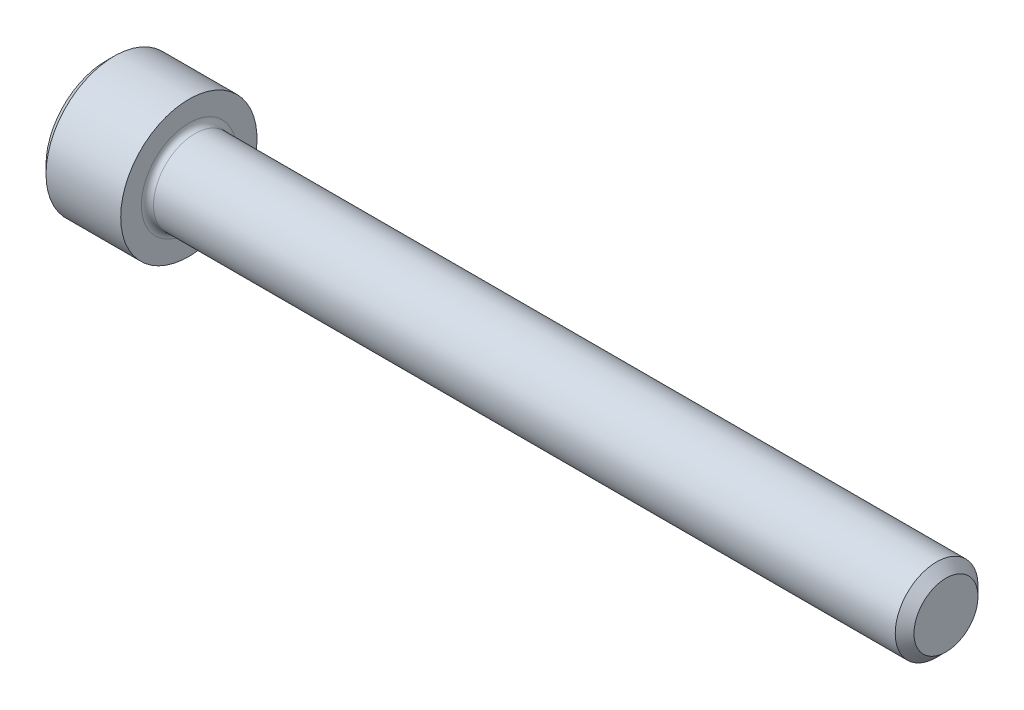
SolidWorks part; units mm, degrees
revolve "Base-Revolve" add sketch "BodySke"
sketch "BodySke" plane through (0, 0, 0) normal (0, 0, 1) x (1, 0, 0)
  line L0 (0, 0) -> (0, 3.0226)
  line L1 (0.4064, 3.429) -> (4.1656, 3.429)
  line L2 (4.1656, 3.429) -> (4.1656, 2.0828)
  line L3 (4.1656, 2.0828) -> (41.7932, 2.0828)
  line L4 (42.2656, 1.6104) -> (42.2656, 0)
  line L5 (42.2656, 0) -> (0, 0)
  line L6 (-31.75, 0) -> (127, 0) construction
  line L7 (0, 3.0226) -> (0.4064, 3.429)
  line L8 (42.2656, 1.6104) -> (41.7932, 2.0828)
  line L9 (0, -3.0226) -> (0.4064, -3.429) construction
  line L10 (42.2656, -1.6104) -> (41.7932, -2.0828) construction
  line L11 (4.9581, 9.525) -> (4.9581, 3.175) construction
  line L12 (13.6906, 9.525) -> (13.6906, 3.175) construction
  line L13 (4.1656, 9.525) -> (4.1656, 3.175) construction
  dimension "Diameter" = 4.1656
  dimension "Head_ht" = 4.1656
  dimension "Length" = 38.1
  dimension "Body_ch_ang" = 45
  dimension "Head_dia" = 6.858
  dimension "Head_ch_ang" = 45
  dimension "Head_side_ht" = 3.7592
  dimension "Minor_dia" = 3.2207
  dimension "Advance" = 0.7925
  dimension "Thread_nom" = 28.575
  dimension "Thread_length" = 38.1
fillet "Fillet1" radius 0.3048 1 edges at (4.1656, 0, 2.0828)
ref_plane "Plane1" through (0, 0, 0) normal (0, 0, 1) x (1, 0, 0)
ref_plane "Plane2" through (0, 0, 0) normal (0, 1, 0) x (1, 0, 0)
ref_plane "Plane3" through (0, 0, 0) normal (1, 0, 0) x (0, 0, -1)
sketch "Sketch2" plane through (0, 0, 0) normal (0, 0, 1) x (1, 0, 0)
  line L0 (0, 1.778) -> (1.9558, 1.778)
  line L1 (1.9558, 1.778) -> (2.9823, 0)
  line L2 (-31.75, 0) -> (127, 0) construction
  line L3 (2.9823, 0) -> (0, 0)
  line L4 (0, 0) -> (0, 1.778)
  line L5 (0, 3.0226) -> (0, -3.0226) construction
  line L6 (0, 0) -> (47.625, 0) construction
  line L7 (4.1656, -3.429) -> (4.1656, 3.429) construction
revolve "Hex-PreBroach" cut sketch "Sketch2" angle 360 about L6
sketch "Sketch3" plane through (0, 0, 0) normal (-1, 0, 0) x (0, 0.5, 0.866)
  line L0 (1.0265, 1.778) -> (-1.0265, 1.778)
  line L1 (-1.0265, 1.778) -> (-2.0531, 0)
  line L2 (1.0265, 1.778) -> (2.0531, 0)
  line L3 (1.0265, -1.778) -> (2.0531, 0)
  line L4 (1.0265, -1.778) -> (-1.0265, -1.778)
  line L5 (-1.0265, -1.778) -> (-2.0531, 0)
extrude "Hex" cut sketch "Sketch3" against normal blind 1.9558
sketch "Sketch4" plane through (0, 0, 0) normal (-1, 0, 0) x (0, 0, 1)
  line L0 (0, 0) -> (2.1971, 0)
  line L1 (0, 0) -> (6.1484, 3.5498) construction
  line L2 (0, 0) -> (1.0985, 1.9027)
  line L3 (1.8302, 0.5287) -> (2.0897, 0.6786)
  line L4 (1.373, 1.3206) -> (1.6325, 1.4704)
  arc A0 (1.8302, 0.5287) -> (1.373, 1.3206) centre (0, 0) ccw
  arc A1 (2.1971, 0) -> (2.0897, 0.6786) centre (0, 0) ccw
  arc A2 (1.0985, 1.9027) -> (1.6325, 1.4704) centre (0, 0) cw
extrude "Spline" [suppressed] cut sketch "Sketch4" against normal blind 1.9558
pattern_circular "CirPattern1" [suppressed] count 6 every 60
sketch "Sketch5" plane through (0, 0, 0) normal (0, 0, 1) x (1, 0, 0)
  line L0 (-31.75, 0) -> (127, 0) construction
  line L2 (0, 3.0226) -> (0, -3.0226) construction
  circle A0 centre (1.524, 0) radius 0.5905
  dimension "Drilled_hole_dia" = 1.1811
  dimension "Drilled_hole_loc" = 1.524
extrude "Hole" [suppressed] cut sketch "Sketch5" against normal through all and the other way through all
pattern_circular "Drilled-4" [suppressed] count 2 every 60
pattern_circular "Drilled-6" [suppressed] count 3 every 60
sketch "ThdSchSke" plane through (0, 0, 0) normal (0, 0, 1) x (1, 0, 0)
  line L0 (13.6906, -1.6104) -> (13.3598, -2.0828)
  line L1 (13.6906, -1.6104) -> (14.0214, -2.0828)
  line L2 (14.0214, -2.0828) -> (14.0214, -2.6035)
  line L3 (-3.175, 0) -> (5.1513, 0) construction
  line L5 (14.0214, -2.6035) -> (13.3598, -2.6035)
  line L6 (13.3598, -2.6035) -> (13.3598, -2.0828)
  line L7 (0, 3.0226) -> (0, -3.0226) construction
revolve "ThreadSchematic" [suppressed] cut sketch "ThdSchSke" angle 360 about L3
pattern_linear "ThdSchPat" [suppressed]
equation "\"D2@Sketch3\" = \"Hex_size@Sketch3\" / 2"
equation "\"D1@Sketch3\" = \"Hex_size@Sketch3\" / 2"
equation "\"D1@Sketch2\" = \"Hex_size@Sketch3\" / 2"
equation "\"D3@Sketch4\" = \"Spline_p_dim@Sketch4\" / 2"
equation "\"Thread_minor@ThreadCosmetic\"  =  \"Minor_dia@BodySke\""
equation "\"D2@CirPattern1\" = 360 / \"Num_teeth@CirPattern1\""
equation "\"Wall_thickness@Sketch2\" = \"Head_ht@BodySke\" - \"Key_eng@Hex\""
equation "\"Thread_length@ThreadCosmetic\" = ((sgn( (\"Length@BodySke\" - \"Advance@BodySke\" ) - \"Thread_nom@BodySke\" )-1)*( (\"Length@BodySke\" - \"Advance@BodySke\" ) - \"Thread_nom@BodySke\" ))/-2+ \"Thread_nom@BodySke\""
equation "\"Thread_minor@ThdSchSke\" = \"Minor_dia@BodySke\""
equation "\"Diameter@ThdSchSke\" = \"Diameter@BodySke\""
equation "\"Overcut@ThdSchSke\" = \"Diameter@BodySke\" * 1.25"
equation "\"Start@ThdSchSke\" = \"Head_ht@BodySke\" + \"Length@BodySke\" - \"Thread_length@ThreadCosmetic\"  '---Non-countersunk---"
equation "\"Num_threads@ThdSchPat\" = int( \"Thread_length@ThreadCosmetic\" / \"Advance@BodySke\" + 0.999 )  + 1"
equation "\"Advance@ThdSchPat\" = \"Thread_length@ThreadCosmetic\" /  (\"Num_threads@ThdSchPat\" - 1) 'relax it"
equation "\"Num_threads@ThdSchPat\" = \"Num_threads@ThdSchPat\" - sgn( \"Num_threads@ThdSchPat\" - 1) '---chamfered tips only---"
